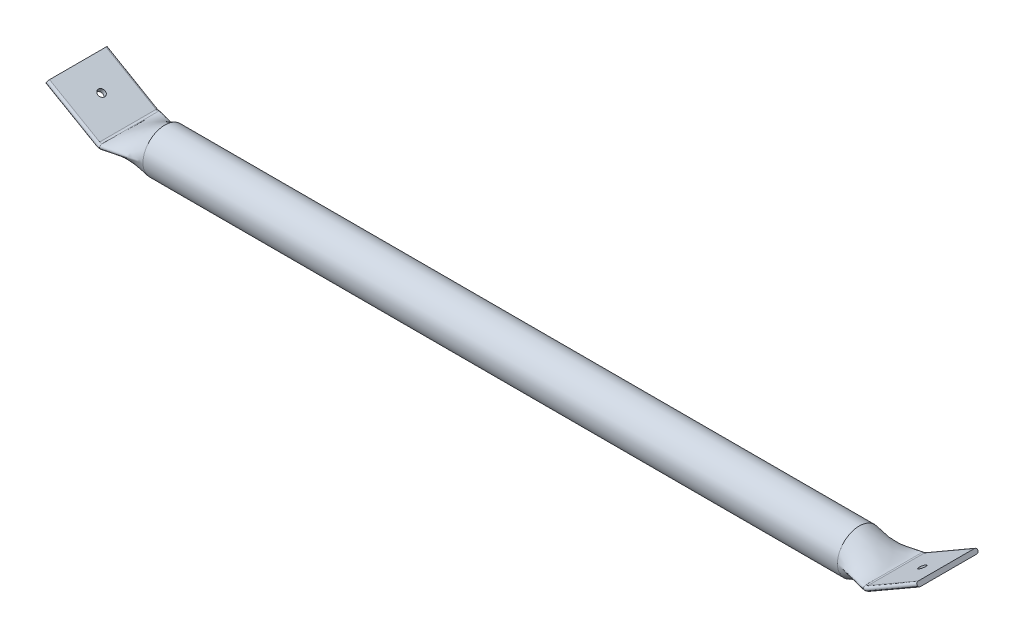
SolidWorks part; units mm, degrees
ref_plane "Front Plane" through (0, 0, 0) normal (0, 0, 1) x (1, 0, 0)
ref_plane "Top Plane" through (0, 0, 0) normal (0, 1, 0) x (1, 0, 0)
ref_plane "Right Plane" through (0, 0, 0) normal (1, 0, 0) x (0, 0, -1)
sketch "Sketch1" plane through (0, 0, 0) normal (1, 0, 0) x (0, 0, -1)
  circle A1 centre (0, 0) radius 23.9141
  dimension "D1" = 47.8282
extrude "Boss-Extrude1" add sketch "Sketch1" along normal mid plane 762
sketch "Sketch2" plane through (0, 0, 0) normal (0, 1, 0) x (1, 0, 0)
  line L0 (0, -33.3375) -> (0, 33.3375) construction
  line L1 (-419.1, 33.3375) -> (419.1, 33.3375)
  line L2 (-419.1, 33.3375) -> (-419.1, -33.3375)
  line L3 (-419.1, -33.3375) -> (419.1, -33.3375)
  line L4 (419.1, 33.3375) -> (419.1, -33.3375)
  line L5 (381, -23.9141) -> (381, 23.9141) construction
  dimension "D1" = 38.1
  dimension "D2" = 66.675
ref_plane "Plane1" through (419.1, 0, 0) normal (1, 0, 0) x (0, 0, -1)
sketch "Sketch3" plane through (419.1, 0, 0) normal (1, 0, 0) x (0, 0, -1)
  line L0 (-30.9245, 2.413) -> (30.9245, 2.413)
  line L1 (-30.9245, -2.413) -> (30.9245, -2.413)
  line L2 (0, 2.413) -> (0, -2.413) construction
  arc A0 (30.9245, 2.413) -> (30.9245, -2.413) centre (30.9245, 0) cw
  arc A1 (-30.9245, 2.413) -> (-30.9245, -2.413) centre (-30.9245, 0) ccw
  dimension "D1" = 4.826
sketch "Sketch4" plane through (381, 0, 0) normal (1, 0, 0) x (0, 0, -1)
  circle A1 centre (0, 0) radius 23.9141
  circle A2 centre (0, 0) radius 23.9141
  dimension "D1" = 0
loft "Loft1" add profiles "Sketch4", "Sketch3"
sketch "Sketch5" plane through (0, 0, 0) normal (0, 0, 1) x (1, 0, 0)
  line L0 (419.1, 2.413) -> (419.1, -2.413)
  line L1 (419.1, 2.413) -> (419.1, 7.239) construction
  line L2 (423.926, -1.1199) -> (419.1, 7.239) construction
  line L3 (421.513, 3.0596) -> (476.5056, 34.8096)
  line L4 (423.926, -1.1199) -> (478.9186, 30.6301)
  line L5 (478.9186, 30.6301) -> (476.5056, 34.8096)
  arc A0 (419.1, 2.413) -> (421.513, 3.0596) centre (419.1, 7.239) ccw
  arc A1 (419.1, -2.413) -> (423.926, -1.1199) centre (419.1, 7.239) ccw
  dimension "D2" = 4.826
  dimension "D1" = 30
  dimension "D3" = 63.5
extrude "Boss-Extrude2" add sketch "Sketch5" along normal up to vertex and the other way up to vertex
sketch "Sketch8" plane through (419.1, 0, 0) normal (1, 0, 0) x (0, 0, -1)
  line L1 (-30.9245, -2.413) -> (-30.9245, 2.413)
  line L2 (-30.9245, -2.413) -> (-30.9245, 2.413)
  arc A1 (-30.9245, 2.413) -> (-30.9245, -2.413) centre (-30.9245, 0) ccw
  arc A2 (-30.9245, 2.413) -> (-30.9245, -2.413) centre (-30.9245, 0) ccw
  dimension "D1" = 0
sketch "Sketch9" plane through (0, 0, 30.9245) normal (0, 0, 1) x (1, 0, 0)
  line L0 (476.5056, 34.8096) -> (421.513, 3.0596) construction
  line L1 (476.5056, 34.8096) -> (421.513, 3.0596)
  arc A0 (419.1, 2.413) -> (421.513, 3.0596) centre (419.1, 7.239) ccw construction
  arc A1 (419.1, 2.413) -> (421.513, 3.0596) centre (419.1, 7.239) ccw
sketch "Sketch10" plane through (0, 0, 30.9245) normal (0, 0, 1) x (1, 0, 0)
  line L0 (423.926, -1.1199) -> (478.9186, 30.6301) construction
  line L1 (423.926, -1.1199) -> (478.9186, 30.6301)
  arc A0 (419.1, -2.413) -> (423.926, -1.1199) centre (419.1, 7.239) ccw construction
  arc A1 (419.1, -2.413) -> (423.926, -1.1199) centre (419.1, 7.239) ccw
sketch "Sketch11" plane through (372.4522, 215.0354, 0) normal (0.866, 0.5, 0) x (0, 0, -1)
  line L0 (-30.9245, -212.9328) -> (-30.9245, -208.1068) construction
  line L1 (-30.9245, -212.9328) -> (-30.9245, -208.1068)
  arc A0 (-30.9245, -208.1068) -> (-30.9245, -212.9328) centre (-30.9245, -210.5198) ccw
loft "Loft2" add profiles "Sketch11", "Sketch8"
sketch "Sketch12" plane through (419.1, 0, 0) normal (1, 0, 0) x (0, 0, -1)
  line L1 (30.9245, 2.413) -> (30.9245, -2.413)
  line L2 (30.9245, 2.413) -> (30.9245, -2.413)
  arc A1 (30.9245, -2.413) -> (30.9245, 2.413) centre (30.9245, 0) ccw
  arc A2 (30.9245, -2.413) -> (30.9245, 2.413) centre (30.9245, 0) ccw
  dimension "D1" = 0
sketch "Sketch13" plane through (372.4522, 215.0354, 0) normal (0.866, 0.5, 0) x (0, 0, -1)
  line L0 (30.9245, -212.9328) -> (30.9245, -208.1068) construction
  line L1 (30.9245, -212.9328) -> (30.9245, -208.1068)
  arc A0 (30.9245, -212.9328) -> (30.9245, -208.1068) centre (30.9245, -210.5198) ccw
sketch "Sketch14" plane through (0, 0, -30.9245) normal (0, 0, -1) x (-1, 0, 0)
  line L0 (-476.5056, 34.8096) -> (-421.513, 3.0596) construction
  line L1 (-476.5056, 34.8096) -> (-421.513, 3.0596)
  arc A0 (-421.513, 3.0596) -> (-419.1, 2.413) centre (-419.1, 7.239) ccw construction
  arc A1 (-421.513, 3.0596) -> (-419.1, 2.413) centre (-419.1, 7.239) ccw
sketch "Sketch15" plane through (0, 0, -30.9245) normal (0, 0, -1) x (-1, 0, 0)
  line L0 (-423.926, -1.1199) -> (-478.9186, 30.6301) construction
  line L1 (-423.926, -1.1199) -> (-478.9186, 30.6301)
  arc A0 (-423.926, -1.1199) -> (-419.1, -2.413) centre (-419.1, 7.239) ccw construction
  arc A1 (-423.926, -1.1199) -> (-419.1, -2.413) centre (-419.1, 7.239) ccw
loft "Loft3" add profiles "Sketch12", "Sketch13"
mirror "Mirror1" about plane through (0, 0, 0) normal (1, 0, 0) of "Loft3", "Loft2", "Loft1", "Boss-Extrude2"
sketch "Sketch6" plane through (-104.0534, -180.2258, 0) normal (0.5, 0.866, 0) x (0.866, -0.5, 0)
  line L0 (-430.0707, 0) -> (-399.9082, 0) construction
  line L1 (-430.0707, -30.9245) -> (-430.0707, 30.9245) construction
  circle A0 centre (-399.9082, 0) radius 3.9688
  dimension "D1" = 7.9375
  dimension "D2" = 30.1625
extrude "Cut-Extrude1" cut sketch "Sketch6" against normal up to surface (4.826 mm away)
sketch "Sketch7" plane through (104.0534, -180.2258, 0) normal (-0.5, 0.866, 0) x (0.866, 0.5, 0)
  line L0 (430.0707, 0) -> (399.9082, 0) construction
  line L1 (430.0707, -30.9245) -> (430.0707, 30.9245) construction
  circle A0 centre (399.9082, 0) radius 3.9688
  dimension "D1" = 7.9375
  dimension "D2" = 30.1625
extrude "Cut-Extrude2" cut sketch "Sketch7" against normal up to surface (4.826 mm away)
sketch "Sketch16" plane through (-0.0002, 557.4798, -560.6112) normal (0, 0.6794, 0.7338) x (0.7144, -0.5135, 0.4754)
  line L0 (335.0457, -777.5926) -> (770.5192, -351.0074) construction
  line L1 (824.9534, -297.6842) -> (280.6115, -830.9157) construction
  circle A0 centre (770.5192, -351.0074) radius 3.9687
  circle A1 centre (552.7824, -564.3) radius 3.9687
  circle A2 centre (335.0457, -777.5926) radius 3.9688
  dimension "D1" = 304.8
  dimension "D2" = 7.9375
extrude "Cut-Extrude3" [suppressed] cut sketch "Sketch16" along normal through all
